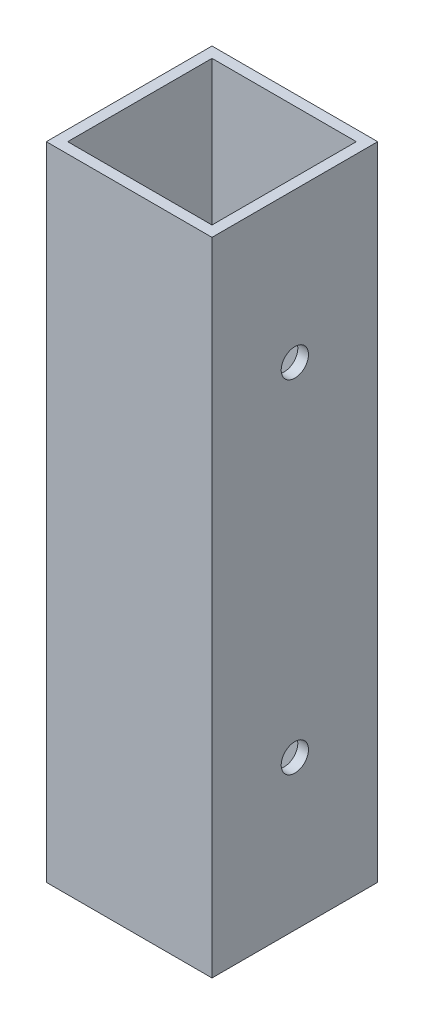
SolidWorks part; units mm, degrees
ref_plane "Front Plane" through (0, 0, 0) normal (0, 0, 1) x (1, 0, 0)
ref_plane "Top Plane" through (0, 0, 0) normal (0, 1, 0) x (1, 0, 0)
ref_plane "Right Plane" through (0, 0, 0) normal (1, 0, 0) x (0, 0, -1)
sketch "Sketch1" plane through (0, 0, 0) normal (0, 1, 0) x (1, 0, 0)
  line L1 (-15.5, -15.5) -> (15.5, -15.5)
  line L2 (-15.5, -15.5) -> (-15.5, 15.5)
  line L3 (-15.5, 15.5) -> (15.5, 15.5)
  line L4 (15.5, -15.5) -> (15.5, 15.5)
  line L5 (-15.5, -15.5) -> (15.5, 15.5) construction
  line L6 (-15.5, 15.5) -> (15.5, -15.5) construction
  line L7 (-13.5, -13.5) -> (13.5, -13.5)
  line L8 (-13.5, -13.5) -> (-13.5, 13.5)
  line L9 (-13.5, 13.5) -> (13.5, 13.5)
  line L10 (13.5, -13.5) -> (13.5, 13.5)
  line L11 (-13.5, -13.5) -> (13.5, 13.5) construction
  line L12 (-13.5, 13.5) -> (13.5, -13.5) construction
  point P0 (0, 0)
  point P6 (0, 0)
  dimension "D1" = 31
  dimension "D2" = 31
  dimension "D3" = 27
extrude "Boss-Extrude1" add sketch "Sketch1" along normal blind 120
hole_wizard "#10 Clearance Hole2" positions "Sketch5" profile "Sketch4" hole size "#10" standard "Ansi Inch"
sketch "Sketch5" plane through (15.5, 0, 0) normal (1, 0, 0) x (0, 0, -1)
  point P0 (0, 92)
  point P1 (0, 28)
sketch "Sketch4" plane through (15.5, 92, 0) normal (0, 1, 0) x (0, 0, -1)
  line L0 (0, 0) -> (0, 6.5338)
  line L1 (0, 6.5338) -> (2.5527, 5)
  line L2 (2.5527, 5) -> (2.5527, 0)
  line L5 (2.5527, 0) -> (0, 0)
  line L10 (0, 6.5338) -> (-2.5527, 5) construction
  line L11 (0, -6.35) -> (0, 107.95) construction
  dimension "Hole Dia." = 5.1054
  dimension "Hole Depth" = 5
  dimension "Drill Angle" = 118
